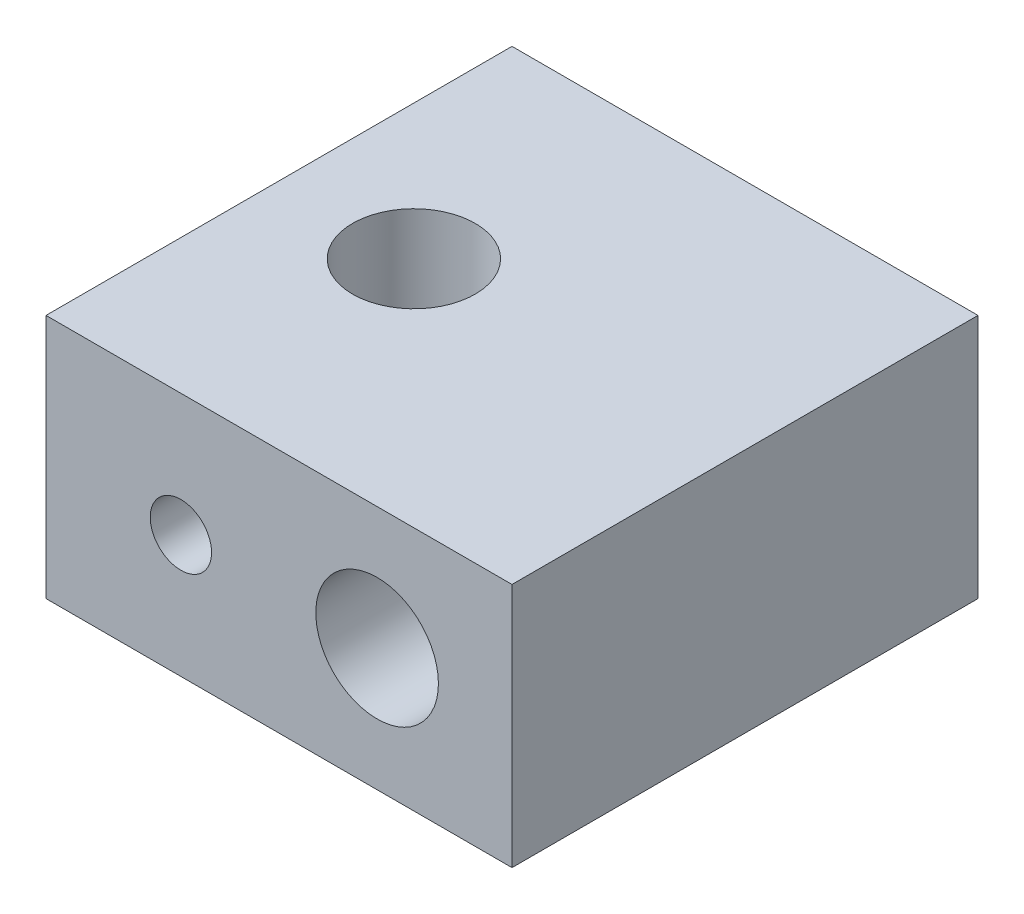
SolidWorks part; units mm, degrees
ref_plane "Front Plane" through (0, 0, 0) normal (0, 0, 1) x (1, 0, 0)
ref_plane "Top Plane" through (0, 0, 0) normal (0, 1, 0) x (1, 0, 0)
ref_plane "Right Plane" through (0, 0, 0) normal (1, 0, 0) x (0, 0, -1)
sketch "Sketch1" plane through (0, 0, 0) normal (0, 1, 0) x (1, 0, 0)
  line L1 (9.5, -9.5) -> (-9.5, -9.5)
  line L2 (9.5, -9.5) -> (9.5, 9.5)
  line L3 (9.5, 9.5) -> (-9.5, 9.5)
  line L4 (-9.5, -9.5) -> (-9.5, 9.5)
  line L5 (9.5, -9.5) -> (-9.5, 9.5) construction
  line L6 (9.5, 9.5) -> (-9.5, -9.5) construction
  point P0 (0, 0)
  dimension "D1" = 19
  dimension "D2" = 19
extrude "Boss-Extrude1" add sketch "Sketch1" along normal blind 10
sketch "Sketch2" plane through (0, 10, 0) normal (0, 1, 0) x (1, 0, 0)
  line L0 (0, 0) -> (-9.5, 0) construction
  line L1 (-9.5, 9.5) -> (-9.5, -9.5) construction
  circle A0 centre (-4, 0) radius 2.5
  dimension "D1" = 5
  dimension "D2" = 5.5
extrude "Cut-Extrude1" cut sketch "Sketch2" against normal through all
sketch "Sketch3" plane through (0, 0, 9.5) normal (0, 0, 1) x (1, 0, 0)
  line L0 (-9.5, 5) -> (9.5, 5) construction
  line L1 (-9.5, 10) -> (-9.5, 0) construction
  line L2 (9.5, 10) -> (9.5, 0) construction
  circle A0 centre (-4, 5) radius 1.25
  dimension "D1" = 2.5
  dimension "D3" = 5.5
extrude "Cut-Extrude2" cut sketch "Sketch3" against normal blind 5
sketch "Sketch4" plane through (0, 0, 9.5) normal (0, 0, 1) x (1, 0, 0)
  line L0 (-9.5, 5) -> (9.5, 5) construction
  line L1 (-9.5, 10) -> (-9.5, 0) construction
  line L2 (9.5, 10) -> (9.5, 0) construction
  circle A0 centre (4, 5) radius 2.5
  dimension "D1" = 5
  dimension "D2" = 5.5
extrude "Cut-Extrude3" cut sketch "Sketch4" against normal through all
sketch "Sketch5" plane through (0, 0, 0) normal (0, -1, 0) x (1, 0, 0)
  line L0 (-9.5, 0) -> (0, 0) construction
  line L1 (-9.5, -9.5) -> (-9.5, 9.5) construction
  circle A0 centre (-4, 0) radius 3.25
  dimension "D1" = 6.5
  dimension "D2" = 5.5
extrude "Cut-Extrude4" cut sketch "Sketch5" against normal blind 1.5
sketch "Sketch6" plane through (0, 0, 0) normal (0, -1, 0) x (1, 0, 0)
  line L0 (-9.5, 0) -> (9.5, 0) construction
  line L1 (-9.5, -9.5) -> (-9.5, 9.5) construction
  line L2 (9.5, 9.5) -> (9.5, -9.5) construction
  circle A0 centre (4, 0) radius 1.25
  dimension "D2" = 2.5
  dimension "D1" = 5.5
extrude "Cut-Extrude5" cut sketch "Sketch6" against normal blind 5
